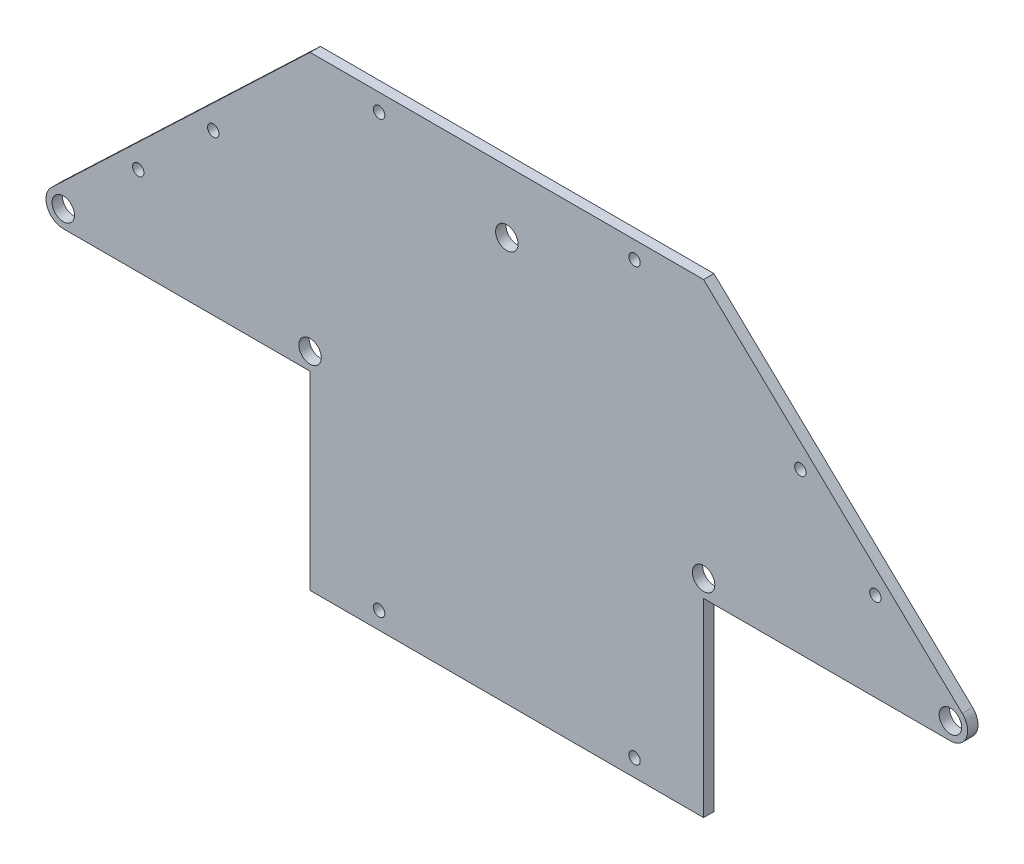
SolidWorks part; units mm, degrees
ref_plane "Front Plane" through (0, 0, 0) normal (0, 0, 1) x (1, 0, 0)
ref_plane "Top Plane" through (0, 0, 0) normal (0, 1, 0) x (1, 0, 0)
ref_plane "Right Plane" through (0, 0, 0) normal (1, 0, 0) x (0, 0, -1)
sketch "Sketch1" plane through (0, 0, 0) normal (0, 0, 1) x (1, 0, 0)
  line L0 (0, 0) -> (257, 0) construction
  line L1 (0, -5) -> (71.5, -5)
  line L2 (128.5, 0) -> (128.5, 36.0515) construction
  line L3 (71.5, 75) -> (185.5, 75)
  line L4 (185.5, 75) -> (260.4483, 3.6207)
  line L5 (71.5, 75) -> (-3.4483, 3.6207)
  line L6 (71.5, -5) -> (71.5, -60)
  line L7 (71.5, -60) -> (185.5, -60)
  line L8 (185.5, -60) -> (185.5, -5)
  line L9 (185.5, -5) -> (257, -5)
  line L10 (0, -5) -> (257, -5) construction
  circle A0 centre (0, 0) radius 3.25
  circle A1 centre (257, 0) radius 3.25
  arc A2 (0, -5) -> (-3.4483, 3.6207) centre (0, 0) cw
  arc A3 (257, -5) -> (260.4483, 3.6207) centre (257, 0) ccw
  circle A4 centre (71.5, 0) radius 3.25
  circle A5 centre (185.5, 0) radius 3.25
  circle A6 centre (128.5, 57) radius 3.25
  circle A8 centre (43.4483, 41.3793) radius 1.65
  circle A9 centre (91.5, 70) radius 1.65
  circle A10 centre (165.5, 70) radius 1.65
  circle A11 centre (213.5517, 41.3793) radius 1.65
  circle A12 centre (91.5, -55) radius 1.65
  circle A13 centre (165.5, -55) radius 1.65
  circle A14 centre (21.7241, 20.6897) radius 1.65
  circle A15 centre (235.2759, 20.6897) radius 1.65
  dimension "D1" = 6.5
  dimension "D5" = 71.5
  dimension "D6" = 71.5
  dimension "D7" = 114
  dimension "D8" = 3.3
  dimension "D4" = 5
  dimension "D15" = 5
  dimension "D16" = 5
  dimension "D17" = 5
  dimension "D18" = 5
  dimension "D19" = 5
  dimension "D20" = 5
  dimension "D21" = 5
  dimension "D22" = 20
  dimension "D23" = 20
  dimension "D24" = 20
  dimension "D25" = 20
  dimension "D26" = 30
  dimension "D27" = 60
  dimension "D28" = 30
  dimension "D29" = 60
  dimension "D2" = 257
  dimension "D9" = 80
  dimension "D10" = 55
  dimension "D11" = 71.5
  dimension "D12" = 71.5
  dimension "D13" = 71.5
  dimension "D14" = 71.5
  dimension "D30" = 57
  dimension "D31" = 136.397
  dimension "D32" = 103.5
  dimension "D33" = 114
  dimension "D3" = 5
extrude "Extrude1" add sketch "Sketch1" along normal blind 3
